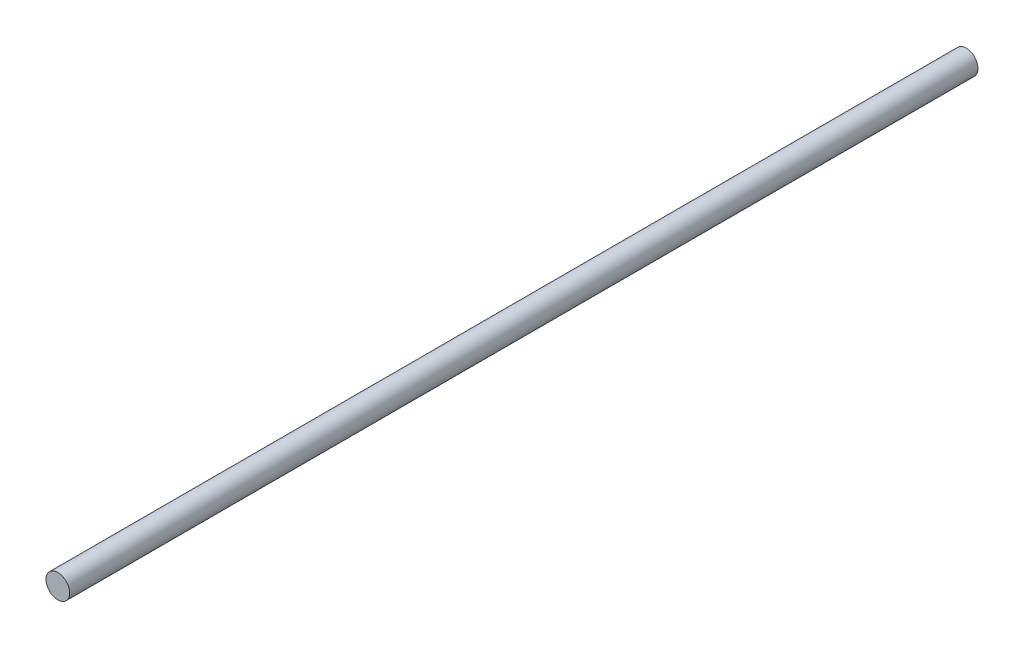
SolidWorks part; units mm, degrees
ref_plane "Front Plane" through (0, 0, 0) normal (0, 0, 1) x (1, 0, 0)
ref_plane "Top Plane" through (0, 0, 0) normal (0, 1, 0) x (1, 0, 0)
ref_plane "Right Plane" through (0, 0, 0) normal (1, 0, 0) x (0, 0, -1)
sketch "Sketch1" plane through (0, 0, 0) normal (0, 0, 1) x (1, 0, 0)
  circle A0 centre (0, 0) radius 30
  dimension "D1" = 60
extrude "Boss-Extrude1" add sketch "Sketch1" against normal blind 2300
